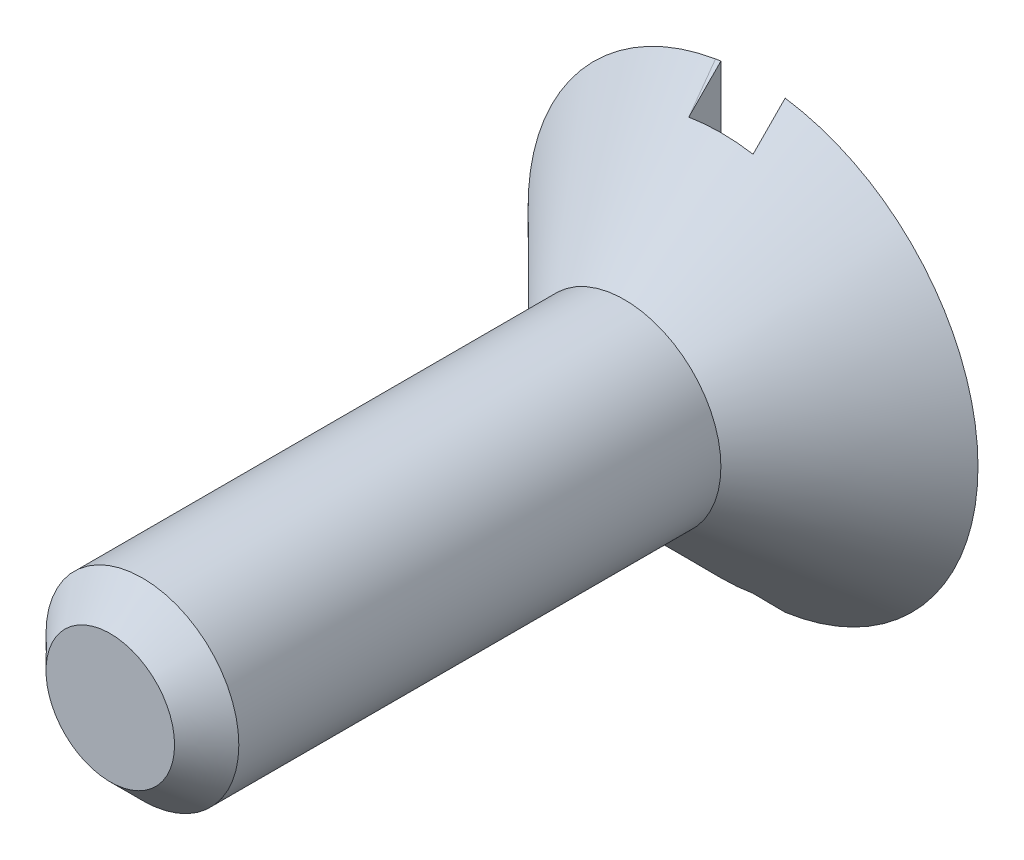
SolidWorks part; units mm, degrees
ref_plane "Plan de face" through (0, 0, 0) normal (0, 0, 1) x (1, 0, 0)
ref_plane "Plan de dessus" through (0, 0, 0) normal (0, 1, 0) x (1, 0, 0)
ref_plane "Plan de droite" through (0, 0, 0) normal (1, 0, 0) x (0, 0, -1)
sketch "Esquisse1" plane through (0, 0, 0) normal (0, 0, 1) x (1, 0, 0)
  circle A0 centre (0, 0) radius 3.5
  dimension "D1" = 7
extrude "Boss.-Extru.1" add sketch "Esquisse1" along normal blind 10
sketch "Esquisse2" plane through (0, 0, 10) normal (0, 0, 1) x (1, 0, 0)
  circle A0 centre (0, 0) radius 1.5
  dimension "D1" = 3
extrude "Enlèv. mat.-Extru.1" cut sketch "Esquisse2" against normal blind 8 flip side to cut
chamfer "Chanfrein1" distance 0.5 angle 45 1 edges at (1.5, 0, 10)
sketch "Esquisse3" plane through (0, 0, 0) normal (0, 0, -1) x (-1, 0, 0)
  line L1 (-0.5, 4) -> (0.5, 4)
  line L2 (-0.5, 4) -> (-0.5, -4)
  line L3 (-0.5, -4) -> (0.5, -4)
  line L4 (0.5, 4) -> (0.5, -4)
  dimension "D1" = 1
  dimension "D2" = 0.5
  dimension "D3" = 4
  dimension "D4" = 8
extrude "Enlèv. mat.-Extru.2" cut sketch "Esquisse3" against normal blind 0.5
chamfer "Chanfrein5" distance 2 angle 45 1 edges at (3.5, 0, 2)
